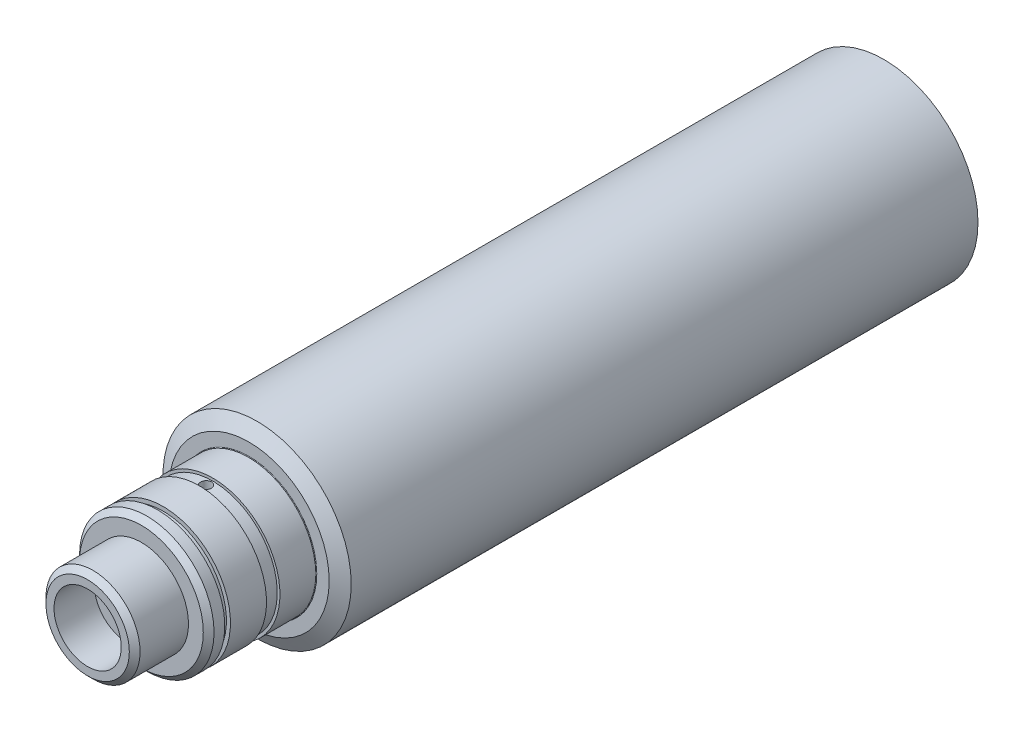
SolidWorks part; units mm, degrees
ref_plane "Plan de face" through (0, 0, 0) normal (0, 0, 1) x (1, 0, 0)
ref_plane "Plan de dessus" through (0, 0, 0) normal (0, 1, 0) x (1, 0, 0)
ref_plane "Plan de droite" through (0, 0, 0) normal (1, 0, 0) x (0, 0, -1)
sketch "Esquisse1" plane through (0, 0, 0) normal (0, 0, 1) x (1, 0, 0)
  circle A0 centre (0, 0) radius 35
  dimension "D1" = 70
extrude "Extrusion1" add sketch "Esquisse1" along normal blind 236
chamfer "Chanfrein1" distance 3 angle 60 1 edges at (35, 0, 236)
sketch "Esquisse2" plane through (0, 0, 0) normal (1, 0, 0) x (0, 0, -1)
  line L0 (-187.8529, 0) -> (-329.4041, 0) construction
  line L1 (-236, 25) -> (-249.5, 25)
  line L2 (-236, 29.8038) -> (-236, -29.8038) construction
  line L3 (-249.5, 25) -> (-249.5, 24)
  line L4 (-249.5, 24) -> (-254.5, 24)
  line L5 (-254.5, 24) -> (-254.5, 25)
  line L6 (-254.5, 25) -> (-276, 25)
  line L7 (-276, 25) -> (-276, 0)
  line L8 (-276, 0) -> (-236, 0)
  line L9 (-236, 0) -> (-236, 25)
  dimension "D1" = 13.5
  dimension "D2" = 5
  dimension "D3" = 40
  dimension "D4" = 50
  dimension "D5" = 48
revolve "Révolution1" add sketch "Esquisse2" angle 360 about L0
chamfer "Chanfrein2" distance 2 angle 45 1 edges at (-25, 0, 276)
ref_plane "Plan1" through (0, 35, 0) normal (0, 1, 0) x (-1, 0, 0)
hole_wizard "Dégagement M3.51" positions "Esquisse8" profile "Esquisse7" hole size "M3.5" standard "ISO"
sketch "Esquisse8" plane through (0, 35, 0) normal (0, 1, 0) x (-1, 0, 0)
  line L1 (25, 236) -> (-25, 236) construction
  point P0 (0, 252)
  dimension "D1" = 16
sketch "Esquisse7" plane through (0, 35, 252) normal (1, 0, 0) x (0, 0, 1)
  line L0 (0, 0) -> (0, 36.2017)
  line L1 (0, 36.2017) -> (2, 35)
  line L2 (2, 35) -> (2, 0)
  line L5 (2, 0) -> (0, 0)
  line L10 (0, 36.2017) -> (-2, 35) construction
  line L11 (0, -6.35) -> (0, 107.95) construction
  dimension "Diamètre du perçage" = 4
  dimension "Profondeur du perçage" = 35
  dimension "Angle de pointe" = 118
sketch "Esquisse12" plane through (0, 0, 0) normal (0, 1, 0) x (1, 0, 0)
  line L0 (25, -274) -> (25, -254.5) construction
  line L1 (25, -267.9) -> (23.5, -267.9)
  line L2 (25, -267.9) -> (25, -270)
  line L3 (25, -270) -> (23.5, -270)
  line L4 (23.5, -267.9) -> (23.5, -270)
  line L5 (-25, -236) -> (25, -236) construction
  line L6 (0, -187.8529) -> (0, -329.4041) construction
  dimension "D1" = 31.9
  dimension "D2" = 2.1
  dimension "D3" = 23.5
revolve "Enlèvement de matière-Révolution1" cut sketch "Esquisse12" angle 360 about axis through (0, 0, 187.8529) along (0, 0, 1)
sketch "Esquisse13" plane through (0, 0, 276) normal (0, 0, 1) x (1, 0, 0)
  circle A0 centre (0, 0) radius 17.5
  dimension "D1" = 35
extrude "Extrusion2" add sketch "Esquisse13" along normal blind 20
sketch "Esquisse19" plane through (0, 0, 296) normal (0, 0, 1) x (1, 0, 0)
  circle A0 centre (0, 0) radius 12.5
  dimension "D1" = 25
extrude "Enlèv. mat.-Extru.1" cut sketch "Esquisse19" against normal blind 15
hole_wizard "Trou taraudé M82" positions "Esquisse24" profile "Esquisse23" tap size "M8" standard "ISO"
sketch "Esquisse24" plane through (0, 0, 281) normal (0, 0, 1) x (1, 0, 0)
  point P0 (0, 0)
sketch "Esquisse23" plane through (0, 0, 281) normal (1, 0, 0) x (0, -1, 0)
  line L0 (0, 0) -> (0, 18.0429)
  line L1 (0, 18.0429) -> (3.4, 16)
  line L2 (3.4, 16) -> (3.4, 0)
  line L5 (3.4, 0) -> (0, 0)
  line L10 (0, 18.0429) -> (-3.4, 16) construction
  line L11 (0, -6.35) -> (0, 107.95) construction
  dimension "Diamètre du trou pour taraudage" = 6.8
  dimension "Profondeur du trou pour taraudage" = 16
  dimension "Angle de pointe" = 118
hole_wizard "Trou taraudé M83" positions "Esquisse26" profile "Esquisse25" tap size "M8" standard "ISO"
sketch "Esquisse26" plane through (0, 0, 0) normal (0, 0, -1) x (-1, 0, 0)
  point P0 (0, 0)
sketch "Esquisse25" plane through (0, 0, 0) normal (1, 0, 0) x (0, 1, 0)
  line L0 (0, 0) -> (0, 18.0429)
  line L1 (0, 18.0429) -> (3.4, 16)
  line L2 (3.4, 16) -> (3.4, 0)
  line L5 (3.4, 0) -> (0, 0)
  line L10 (0, 18.0429) -> (-3.4, 16) construction
  line L11 (0, -6.35) -> (0, 107.95) construction
  dimension "Diamètre du trou pour taraudage" = 6.8
  dimension "Profondeur du trou pour taraudage" = 16
  dimension "Angle de pointe" = 118
sketch "Esquisse27" plane through (0, 0, 281) normal (0, 0, 1) x (1, 0, 0)
  circle A0 centre (0, 0) radius 3.4
  dimension "D1" = 6.8
extrude "Enlèv. mat.-Extru.3" cut sketch "Esquisse27" against normal through all
fillet "Congé1" radius 0.2 1 edges at (25, 0, 236)
chamfer "Chanfrein3" distance 2 angle 45 1 edges at (17.5, 0, 296)
